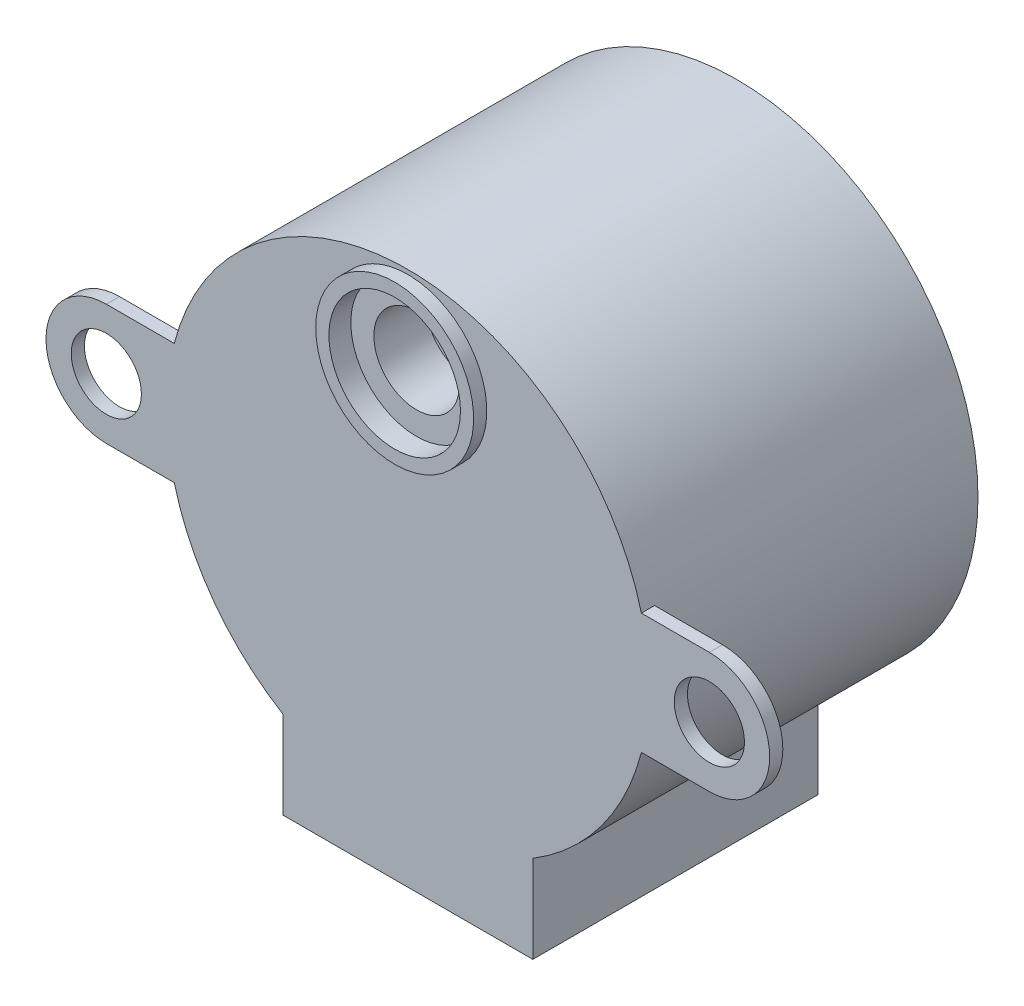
SolidWorks part; units mm, degrees
ref_plane "Front Plane" through (0, 0, 0) normal (0, 0, 1) x (1, 0, 0)
ref_plane "Top Plane" through (0, 0, 0) normal (0, 1, 0) x (1, 0, 0)
ref_plane "Right Plane" through (0, 0, 0) normal (1, 0, 0) x (0, 0, -1)
sketch "Sketch1" plane through (0, 0, 0) normal (0, 0, 1) x (1, 0, 0)
  circle A0 centre (0, 0) radius 13.97
  dimension "D1" = 27.94
extrude "Boss-Extrude1" add sketch "Sketch1" along normal blind 19.05
sketch "Sketch2" plane through (0, 0, 19.05) normal (0, 0, 1) x (1, 0, 0)
  line L0 (17.4625, 0) -> (-17.4625, 0) construction
  line L1 (17.4625, -3.4925) -> (-17.4625, -3.4925)
  line L2 (17.4625, 3.4925) -> (-17.4625, 3.4925)
  arc A0 (17.4625, -3.4925) -> (17.4625, 3.4925) centre (17.4625, 0) ccw
  arc A1 (-17.4625, 3.4925) -> (-17.4625, -3.4925) centre (-17.4625, 0) ccw
  point P2 (0, 0)
  point P8 (-20.955, 0)
  point P9 (20.955, 0)
  dimension "D1" = 6.985
  dimension "D2" = 41.91
extrude "Boss-Extrude2" add sketch "Sketch2" against normal blind 0.762
sketch "Sketch3" plane through (0, 0, 19.05) normal (0, 0, 1) x (1, 0, 0)
  circle A0 centre (-17.4625, 0) radius 2.032
  circle A1 centre (17.4625, 0) radius 2.032
  dimension "D1" = 4.064
  dimension "D2" = 4.064
extrude "Cut-Extrude1" cut sketch "Sketch3" against normal through all
sketch "Sketch6" plane through (0, 0, 19.05) normal (0, 0, 1) x (1, 0, 0)
  circle A0 centre (0, 9.144) radius 4.572
  arc A1 (13.5264, 3.4925) -> (-13.5264, 3.4925) centre (0, 0) ccw construction
  dimension "D1" = 9.144
  dimension "D2" = 9.144
extrude "Boss-Extrude3" add sketch "Sketch6" along normal blind 0.762
sketch "Sketch7" plane through (0, 0, 19.05) normal (0, 0, 1) x (1, 0, 0)
  line L0 (-9.8705, 13.97) -> (10.0429, 13.97) construction
  line L1 (-7.239, -11.8026) -> (7.239, -11.8026)
  line L2 (-7.239, -11.8026) -> (-7.239, -17.018)
  line L3 (-7.239, -17.018) -> (7.239, -17.018)
  line L4 (7.239, -11.8026) -> (7.239, -17.018)
  dimension "D1" = 30.988
  dimension "D2" = 14.478
  dimension "D3" = 7.239
extrude "Boss-Extrude4" add sketch "Sketch7" against normal blind 16.51
sketch "Sketch8" plane through (0, 0, 19.812) normal (0, 0, 1) x (1, 0, 0)
  circle A0 centre (0, 9.144) radius 3.81
  circle A1 centre (0, 9.144) radius 4.572 construction
  dimension "D1" = 0.762
extrude "Cut-Extrude6" cut sketch "Sketch8" against normal blind 1.27
sketch "Sketch9" plane through (0, 0, 18.542) normal (0, 0, 1) x (1, 0, 0)
  circle A0 centre (0, 9.144) radius 2.4765
  dimension "D1" = 4.953
extrude "Cut-Extrude7" cut sketch "Sketch9" against normal blind 3.048
